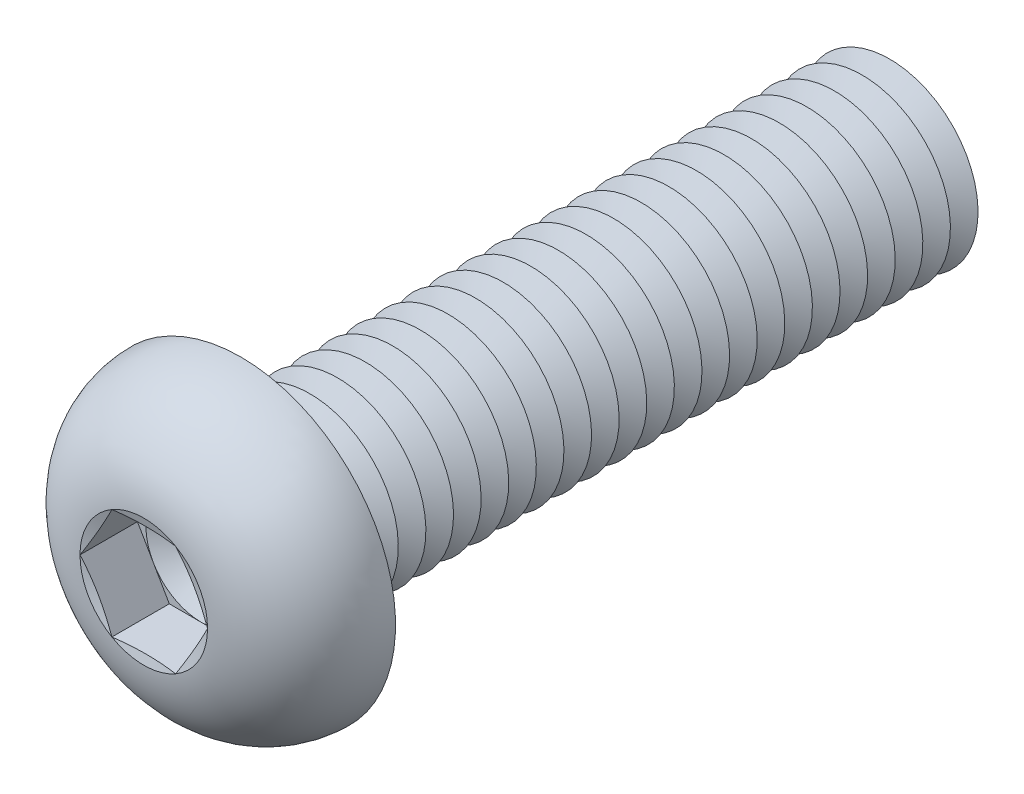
SolidWorks part; units mm, degrees
ref_plane "Front Plane" through (0, 0, 0) normal (0, 0, 1) x (1, 0, 0)
ref_plane "Top Plane" through (0, 0, 0) normal (0, 1, 0) x (1, 0, 0)
ref_plane "Right Plane" through (0, 0, 0) normal (1, 0, 0) x (0, 0, -1)
sketch "Sketch1" plane through (0, 0, 0) normal (1, 0, 0) x (0, 0, -1)
  line L0 (0, 4) -> (0, 7)
  line L3 (0, 4) -> (30, 4)
  line L4 (30, 4) -> (30, 0)
  line L5 (30, 0) -> (-4.4, 0) construction
  line L6 (-4.4, 0) -> (30, 0)
  line L7 (-4.4, 2.8867) -> (-4.4, 1.4434) construction
  line L8 (-4.4, 1.4434) -> (-4.4, 0)
  line L9 (-4.4, 2.8867) -> (-4.0132, 1.4434)
  line L10 (-4.0132, 1.4434) -> (-4.4, 1.4434)
  line L11 (30, 0) -> (22.7481, 0) construction
  line L12 (0, 7) -> (-4.4, 7) construction
  arc A1 (0, 7) -> (-4.4, 2.8867) centre (0, 2.59) ccw
  point P8 (30, 2)
  dimension "D1" = 14
  dimension "D2" = 8
  dimension "D3" = 4.4
  dimension "D4" = 5.7735
  dimension "D5" = 30
  dimension "D6" = 15
revolve "Revolve1" add sketch "Sketch1" angle 360 about L5
fillet "Fillet1" radius 0.625 1 edges at (0, 4, 0)
sketch "Sketch2" plane through (0, 0, 0) normal (1, 0, 0) x (0, 0, -1)
  line L0 (29.375, 4) -> (30.625, 4)
  line L1 (30, 4) -> (0.625, 4) construction
  line L2 (30.625, 4) -> (30, 2.9175)
  line L3 (30, -4) -> (30, 4) construction
  line L4 (30, 2.9175) -> (29.375, 4)
  dimension "D1" = 1.25
revolve "Cut-Revolve1" cut sketch "Sketch2" angle 360 about axis through (0, 0, -30) along (0, 0, -1)
pattern_linear "LPattern1" count 24 spacing 1.25 along (0, 0, 1) of "Cut-Revolve1"
sketch "Sketch3" plane through (0, 0, 4.4) normal (0, 0, 1) x (1, 0, 0)
  line L7 (1.4434, 2.5) -> (-1.4434, 2.5)
  line L8 (-1.4434, 2.5) -> (-2.8867, 0)
  line L9 (-2.8867, 0) -> (-1.4434, -2.5)
  line L10 (-1.4434, -2.5) -> (1.4434, -2.5)
  line L11 (1.4434, -2.5) -> (2.8867, 0)
  line L12 (2.8867, 0) -> (1.4434, 2.5)
  circle A0 centre (0, 0) radius 2.5 construction
  circle A3 centre (0, 0) radius 2.8867 construction
extrude "Cut-Extrude1" cut sketch "Sketch3" against normal blind 2.6
sketch "Sketch4" plane through (0, 0, 1.8) normal (0, 0, 1) x (1, 0, 0)
  line L1 (1.4434, 2.5) -> (-1.4434, 2.5) construction
  circle A0 centre (0, 0) radius 2.5
extrude "Cut-Extrude2" cut sketch "Sketch4" against normal through all draft 60
